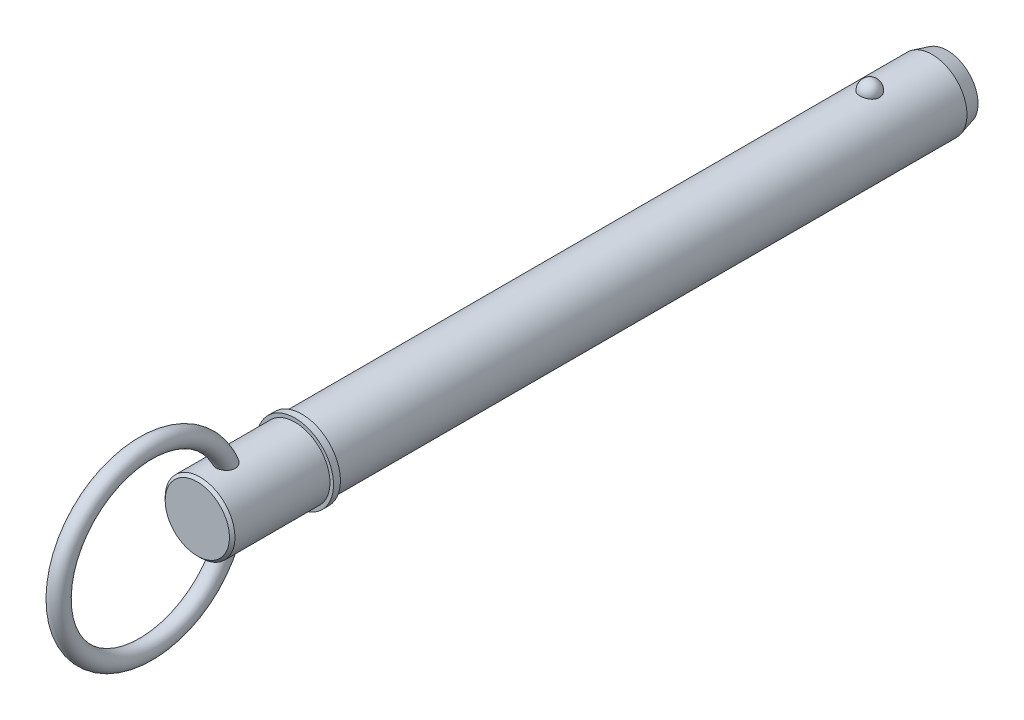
SolidWorks part; units mm, degrees
ref_plane "Front Plane" through (0, 0, 0) normal (0, 0, 1) x (1, 0, 0)
ref_plane "Top Plane" through (0, 0, 0) normal (0, 1, 0) x (1, 0, 0)
ref_plane "Right Plane" through (0, 0, 0) normal (1, 0, 0) x (0, 0, -1)
sketch "Sketch2" plane through (0, 0, 0) normal (0, 0, 1) x (1, 0, 0)
  circle A0 centre (0, 0) radius 12.7
  point P3 (0, 12.7)
  dimension "D1" = 25.4
extrude "Boss-Extrude1" add sketch "Sketch2" along normal blind 203.2
sketch "Sketch3" plane through (0, 0, 0) normal (0, 0, -1) x (-1, 0, 0)
  circle A0 centre (0, 0) radius 12.7
  dimension "D1" = 25.4
extrude "Boss-Extrude2" add sketch "Sketch3" along normal blind 31.75
chamfer "Chamfer1" distance 5.5 angle 15 1 edges at (-12.7, 0, -31.75)
sketch "Sketch18" plane through (0, 0, 0) normal (1, 0, 0) x (0, 0, -1)
  line L0 (26.25, 12.7) -> (-203.2, 12.7) construction
  line L1 (3.56, 16.26) -> (3.56, 9.14)
  line L2 (-203.2, -12.7) -> (26.25, -12.7) construction
  arc A0 (3.56, 16.26) -> (3.56, 9.14) centre (3.56, 12.7) ccw
  point P4 (0, 12.7)
  dimension "D1" = 28.96
revolve "Revolve1" add sketch "Sketch18" angle 360 about L1
sketch "Sketch19" plane through (0, 0, 0) normal (1, 0, 0) x (0, 0, -1)
  line L0 (-33.7288, 0) -> (-46.4542, 0) construction
sketch "Sketch20" plane through (0, 0, 0) normal (1, 0, 0) x (0, 0, -1)
  line L0 (-203.2, 0) -> (-203.2, 14)
  line L1 (-203.2, 12.7) -> (-203.2, -12.7) construction
  line L2 (-203.2, 14) -> (-205.7, 14)
  line L3 (-205.7, 14) -> (-205.7, 0)
  line L4 (-33.7288, 0) -> (-46.4542, 0) construction
  line L5 (-205.7, 0) -> (-203.2, 0)
  dimension "D1" = 14
  dimension "D2" = 2.5
revolve "Revolve2" add sketch "Sketch20" angle 360 about L0
sketch "Sketch21" plane through (0, 0, 203.2) normal (0, 0, -1) x (-1, 0, 0)
  circle A0 centre (0, 0) radius 12.7
  dimension "D1" = 25.4
extrude "Boss-Extrude3" add sketch "Sketch21" against normal blind 38.1
chamfer "Chamfer2" distance 1 angle 45 1 edges at (-12.7, 0, 241.3)
sketch "Sketch23" plane through (0, 0, 0) normal (1, 0, 0) x (0, 0, -1)
  line L0 (-241.3, 11.7) -> (-241.3, -11.7) construction
  circle A0 centre (-260.05, 0) radius 31.75
  point P2 (-228.3, 0)
  dimension "D1" = 63.5
  dimension "D2" = 13
sketch "Sketch24" plane through (0, 0, 0) normal (0, 1, 0) x (1, 0, 0)
  circle A0 centre (0, -228.3) radius 3.25
  dimension "D1" = 6.5
sweep "Sweep1" add profiles "Sketch24" path "Sketch23"
